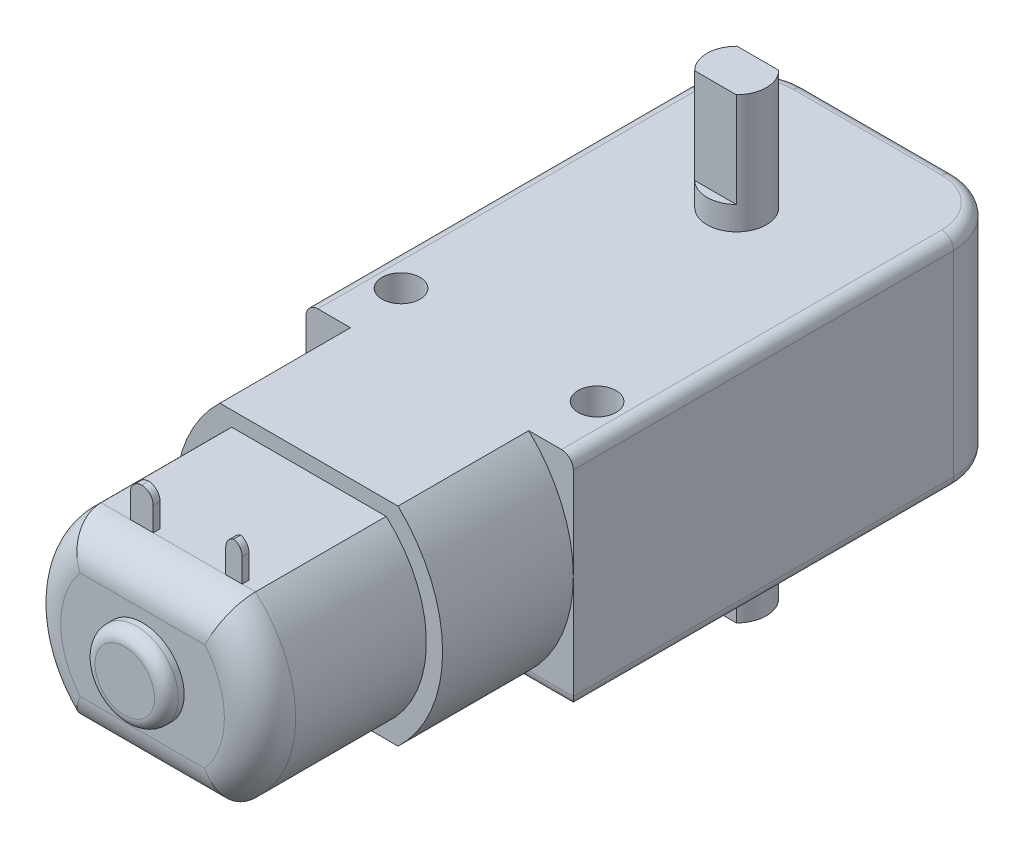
SolidWorks part; units mm, degrees
ref_plane "Plan de face" through (0, 0, 0) normal (0, 0, 1) x (1, 0, 0)
ref_plane "Plan de dessus" through (0, 0, 0) normal (0, 1, 0) x (1, 0, 0)
ref_plane "Plan de droite" through (0, 0, 0) normal (1, 0, 0) x (0, 0, -1)
sketch "Esquisse1" plane through (0, 0, 0) normal (0, 0, 1) x (1, 0, 0)
  line L1 (-11.25, 9.25) -> (11.25, 9.25)
  line L2 (-11.25, 9.25) -> (-11.25, -9.25)
  line L3 (-11.25, -9.25) -> (11.25, -9.25)
  line L4 (11.25, 9.25) -> (11.25, -9.25)
  dimension "D1" = 18.5
  dimension "D2" = 22.5
  dimension "D3" = 9.25
  dimension "D4" = 11.25
extrude "Boss.-Extru.1" add sketch "Esquisse1" along normal blind 37
fillet "Congé1" radius 5 2 edges at (-11.25, 0, 0) (11.25, 0, 0)
fillet "Congé2" radius 1 6 edges at (0, -9.25, 37) (11.25, -9.25, 21) (9.7855, -9.25, 1.4645) (0, -9.25, 0) (-9.7855, -9.25, 1.4645) (-11.25, -9.25, 21)
fillet "Congé3" radius 1 5 edges at (9.7855, 9.25, 1.4645) (11.25, 9.25, 21) (-11.25, 9.25, 21) (-9.7855, 9.25, 1.4645) (0, 9.25, 0)
sketch "Esquisse3" plane through (0, 0, 0) normal (0, 0, -1) x (-1, 0, 0)
  line L1 (2.5, 1.5) -> (-2.5, 1.5)
  line L2 (2.5, 1.5) -> (2.5, -1.5)
  line L3 (2.5, -1.5) -> (-2.5, -1.5)
  line L4 (-2.5, 1.5) -> (-2.5, -1.5)
  dimension "D1" = 3
  dimension "D2" = 5
  dimension "D3" = 2.5
  dimension "D4" = 1.5
extrude "Boss.-Extru.2" add sketch "Esquisse3" along normal blind 5
fillet "Congé4" radius 1 2 edges at (2.5, 0, -5) (-2.5, 0, -5)
sketch "Esquisse4" plane through (0, -1.5, 0) normal (0, -1, 0) x (1, 0, 0)
  line L0 (1.5, -5) -> (-1.5, -5) construction
  circle A0 centre (0, -2.5) radius 1.25
  dimension "D1" = 2.5
  dimension "D2" = 2.5
extrude "Enlèv. mat.-Extru.1" cut sketch "Esquisse4" against normal blind 5
sketch "Esquisse6" plane through (0, 0, 37) normal (0, 0, 1) x (1, 0, 0)
  line L0 (10.25, 9.25) -> (-10.25, 9.25) construction
  line L1 (-7.5, -8.25) -> (7.5, -8.25)
  line L3 (-7.5, 9.25) -> (7.5, 9.25)
  line L5 (-11.25, -8.25) -> (11.25, -8.25) construction
  arc A0 (-7.5, -8.25) -> (-7.5, 9.25) centre (0.8333, 0.5) cw
  arc A1 (7.5, -8.25) -> (7.5, 9.25) centre (-0.8333, 0.5) ccw
  point P8 (0, -8.25)
  dimension "D2" = 15
  dimension "D3" = 7.5
extrude "Boss.-Extru.3" add sketch "Esquisse6" along normal blind 11
sketch "Esquisse8" plane through (0, 0, 48) normal (0, 0, 1) x (1, 0, 0)
  line L0 (7.5, 9.25) -> (-7.5, 9.25) construction
  line L1 (-6.5, 8) -> (6.5, 8)
  line L3 (-6.5, -7) -> (6.5, -7)
  arc A0 (-6.5, 8) -> (-6.5, -7) centre (0.1144, 0.5) ccw
  arc A1 (6.5, 8) -> (6.5, -7) centre (-0.1144, 0.5) cw
  dimension "D4" = 10
  dimension "D5" = 10
  dimension "D1" = 15
  dimension "D2" = 13
  dimension "D3" = 7.5
extrude "Boss.-Extru.5" add sketch "Esquisse8" along normal blind 14
fillet "Congé6" radius 3 4 edges at (0, 8, 62) (9.8856, 0.5, 62) (0, -7, 62) (-9.8856, 0.5, 62)
sketch "Esquisse9" plane through (0, -9.25, 0) normal (0, -1, 0) x (-1, 0, 0)
  line L0 (-6.25, 0) -> (6.25, 0) construction
  circle A0 centre (0, -12) radius 2.5
  dimension "D1" = 5
  dimension "D2" = 12
extrude "Boss.-Extru.6" add sketch "Esquisse9" along normal blind 2
sketch "Esquisse10" plane through (0, -11.25, 0) normal (0, -1, 0) x (1, 0, 0)
  line L1 (1.75, 13.7854) -> (-1.75, 13.7854)
  line L3 (1.75, 10.2146) -> (-1.75, 10.2146)
  circle A0 centre (0, 12) radius 2.5 construction
  arc A1 (1.75, 13.7854) -> (1.75, 10.2146) centre (0, 12) cw
  arc A2 (-1.75, 13.7854) -> (-1.75, 10.2146) centre (0, 12) ccw
  dimension "D1" = 3.5
  dimension "D2" = 3.5
extrude "Boss.-Extru.7" add sketch "Esquisse10" along normal blind 8
mirror "Symétrie1" about plane through (0, 0, 0) normal (0, 1, 0) of "Boss.-Extru.7", "Boss.-Extru.6"
sketch "Esquisse11" plane through (0, -9.25, 0) normal (0, -1, 0) x (1, 0, 0)
  line L0 (-11.25, 37) -> (-7.5, 37) construction
  line L1 (-10.25, 36) -> (-10.25, 5) construction
  circle A0 centre (-8.25, 32) radius 1.6
  dimension "D1" = 3.2
  dimension "D3" = 2
  dimension "D2" = 5
extrude "Enlèv. mat.-Extru.5" cut sketch "Esquisse11" against normal blind 32
mirror "Symétrie2" about plane through (0, 0, 0) normal (1, 0, 0) of "Enlèv. mat.-Extru.5"
sketch "Esquisse12" plane through (0, 0, 62) normal (0, 0, 1) x (1, 0, 0)
  line L1 (-5.2475, -4) -> (5.2475, -4) construction
  circle A1 centre (0, 0.5) radius 3.5
  dimension "D1" = 7
  dimension "D2" = 4.5
extrude "Boss.-Extru.8" add sketch "Esquisse12" along normal blind 1.5
fillet "Congé7" radius 1 1 edges at (3.5, 0.5, 63.5)
sketch "Esquisse13" plane through (0, 8, 0) normal (0, 1, 0) x (1, 0, 0)
  line L0 (-6.5, -59) -> (6.5, -59) construction
  line L1 (5.3771, -58.4235) -> (3.9959, -58.4235)
  line L2 (5.3771, -58.4235) -> (5.3771, -59)
  line L3 (5.3771, -59) -> (3.9959, -59)
  line L4 (3.9959, -58.4235) -> (3.9959, -59)
  line L6 (-2.1038, -58.4235) -> (-4.0325, -58.4235)
  line L7 (-2.1038, -58.4235) -> (-2.1038, -59)
  line L8 (-2.1038, -59) -> (-4.0325, -59)
  line L9 (-4.0325, -58.4235) -> (-4.0325, -59)
  dimension "D1" = 0.5765
  dimension "D2" = 1.3813
  dimension "D3" = 0.5765
  dimension "D4" = 1.9287
extrude "Boss.-Extru.9" add sketch "Esquisse13" along normal blind 3
fillet "Congé8" radius 1 4 edges at (-4.0325, 11, 58.7117) (-2.1038, 11, 58.7117) (5.3771, 11, 58.7117) (3.9959, 11, 58.7117)
